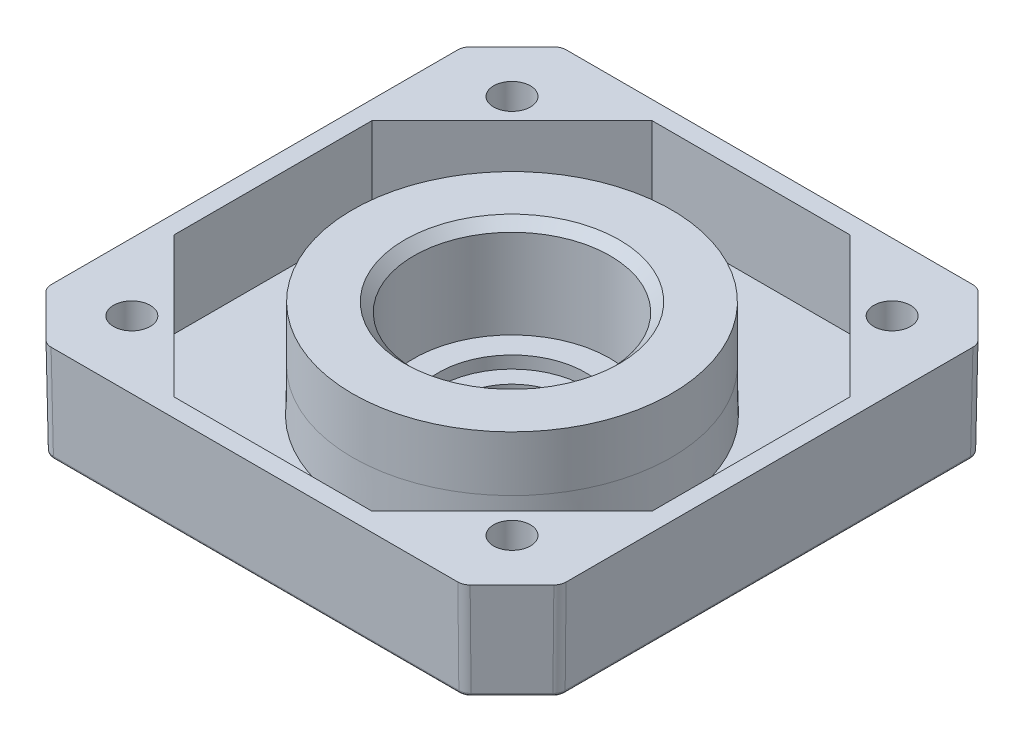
SolidWorks part; units mm, degrees
ref_plane "Front Plane" through (0, 0, 0) normal (0, 0, 1) x (1, 0, 0)
ref_plane "Top Plane" through (0, 0, 0) normal (0, 1, 0) x (1, 0, 0)
ref_plane "Right Plane" through (0, 0, 0) normal (1, 0, 0) x (0, 0, -1)
sketch "Sketch1" plane through (0, 0, 0) normal (0, 1, 0) x (1, 0, 0)
  line L0 (-17, 21) -> (-21, 17)
  line L1 (-17, 21) -> (17, 21)
  line L2 (-21, 17) -> (-21, -17)
  line L3 (-17, -21) -> (17, -21)
  line L4 (21, 17) -> (21, -17)
  line L5 (-21, -17) -> (-17, -21)
  line L6 (17, -21) -> (21, -17)
  line L7 (17, 21) -> (21, 17)
  point P1 (0, 21)
  point P2 (21, 0)
  dimension "D1" = 42
  dimension "D2" = 4
extrude "Boss-Extrude1" add sketch "Sketch1" against normal blind 8 draft 1
sketch "Sketch14" plane through (0, -8, 0) normal (0, -1, 0) x (1, 0, 0)
  circle A0 centre (0, 0) radius 11
  dimension "D1" = 22
extrude "Boss-Extrude8" add sketch "Sketch14" along normal blind 2
fillet "Fillet2" radius 1 8 edges at (-20.9302, -4, 16.9711) (-16.9711, -4, 20.9302) (16.9711, -4, 20.9302) (20.9302, -4, 16.9711) (-20.9302, -4, -16.9711) (-16.9711, -4, -20.9302) (20.9302, -4, -16.9711) (16.9711, -4, -20.9302)
sketch "Sketch2" plane through (0, 0, 0) normal (0, 1, 0) x (1, 0, 0)
  line L3 (-8.0772, 19.5) -> (-19.5, 8.0772)
  line L4 (-19.5, 8.0772) -> (-19.5, -8.0772)
  line L5 (-19.5, -8.0772) -> (-8.0772, -19.5)
  line L6 (-8.0772, -19.5) -> (8.0772, -19.5)
  line L7 (8.0772, -19.5) -> (19.5, -8.0772)
  line L8 (19.5, -8.0772) -> (19.5, 8.0772)
  line L9 (19.5, 8.0772) -> (8.0772, 19.5)
  line L10 (-19.5, 8.0772) -> (8.0772, -19.5) construction
  line L12 (-19.5, 0) -> (19.5, 0) construction
  line L39 (-8.0772, 19.5) -> (8.0772, 19.5)
  point P2 (0, 0)
  dimension "D3" = 39
extrude "Cut-Extrude1" cut sketch "Sketch2" against normal blind 7
sketch "Sketch6" plane through (0, -7, 0) normal (0, 1, 0) x (1, 0, 0)
  circle A0 centre (0, 0) radius 13
  dimension "D1" = 26
extrude "Boss-Extrude5" add sketch "Sketch6" against normal up to body draft 1 from offset 3.5 separate body
sketch "Sketch7" plane through (0, -3.5, 0) normal (0, 1, 0) x (1, 0, 0)
  circle A1 centre (0, 0) radius 13
  circle A2 centre (0, 0) radius 13
  dimension "D1" = 0
extrude "Boss-Extrude6" add sketch "Sketch7" along normal blind 4.5
sketch "Sketch9" plane through (0, 0, 0) normal (0, 0, 1) x (1, 0, 0)
  line L1 (13, 1) -> (-13, 1) construction
  line L2 (6, -7) -> (6, -8)
  line L3 (6, -8) -> (4.5, -8)
  line L4 (4.5, -8) -> (4.5, -9.5)
  line L5 (5, -10) -> (0, -10)
  line L7 (0, 1) -> (8.75, 1)
  line L9 (0, 1) -> (0, -10) construction
  line L10 (6, -7) -> (8, -7)
  line L11 (8, -7) -> (8, 0.25)
  line L12 (8, 0.25) -> (8.75, 1)
  line L13 (0, 1) -> (0, -10)
  line L14 (-11, -10) -> (11, -10) construction
  arc A0 (4.5, -9.5) -> (5, -10) centre (5, -9.5) ccw
  dimension "D8" = 0.5
  dimension "D1" = 9
  dimension "D2" = 12
  dimension "D3" = 16
  dimension "D4" = 135
  dimension "D5" = 0.75
  dimension "D6" = 8
  dimension "D7" = 9
revolve "Cut-Revolve1" cut sketch "Sketch9" angle 360 about L9
sketch "Sketch15" plane through (0, 0, 0) normal (0, 1, 0) x (1, 0, 0)
  line L0 (-15.5, -15.5) -> (-15.5, 15.5) construction
  line L1 (-15.5, 15.5) -> (15.5, 15.5) construction
  circle A0 centre (-15.5, 15.5) radius 1.5
  circle A1 centre (-15.5, -15.5) radius 1.5
  circle A2 centre (15.5, -15.5) radius 1.5
  circle A3 centre (15.5, 15.5) radius 1.5
  point P8 (0, 15.5)
  point P9 (-15.5, 0)
  dimension "D2" = 3
  dimension "D1" = 31
extrude "Cut-Extrude7" cut sketch "Sketch15" against normal through all
fillet "Fillet3" radius 0.25 2 edges at (0, -8, -11) (0, -10, -11)
fillet "Fillet4" radius 0.25 16 edges at (-20.7843, -8, -16.9106) (-18.9013, -8, -18.9013) (-16.9106, -8, -20.7843) (0, -8, -20.8604) (16.9106, -8, -20.7843) (18.9013, -8, -18.9013) (20.7843, -8, -16.9106) (20.8604, -8, 0) (20.7843, -8, 16.9106) (18.9013, -8, 18.9013) (16.9106, -8, 20.7843) (0, -8, 20.8604) (-16.9106, -8, 20.7843) (-18.9013, -8, 18.9013) (-20.7843, -8, 16.9106) (-20.8604, -8, 0)
